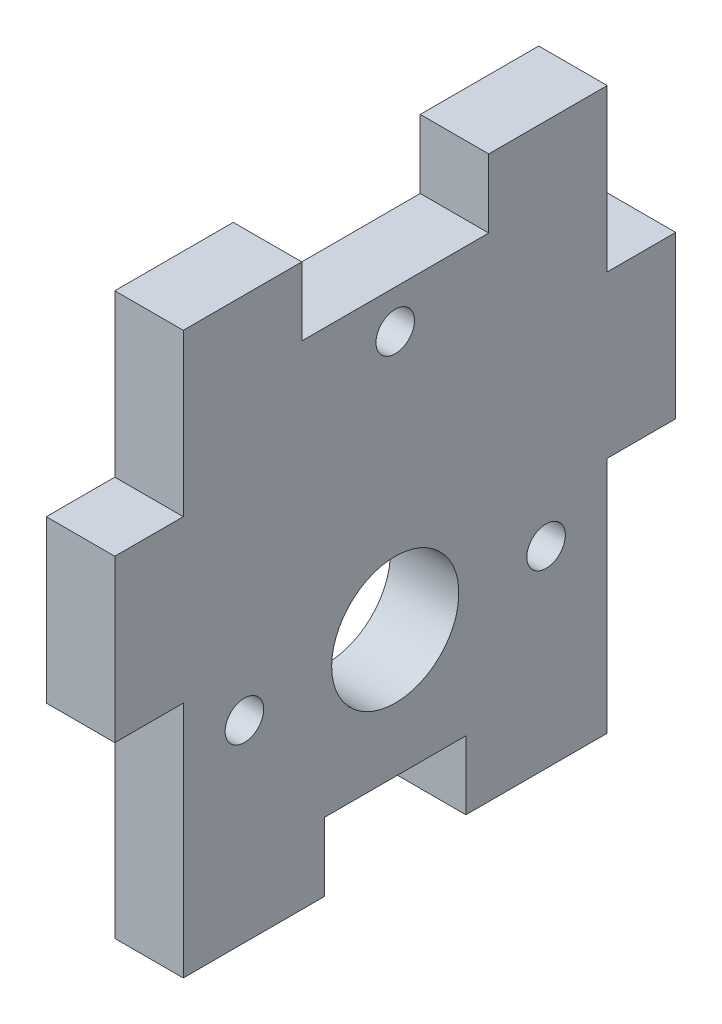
SolidWorks part; units mm, degrees
ref_plane "Front Plane" through (0, 0, 0) normal (0, 0, 1) x (1, 0, 0)
ref_plane "Top Plane" through (0, 0, 0) normal (0, 1, 0) x (1, 0, 0)
ref_plane "Right Plane" through (0, 0, 0) normal (1, 0, 0) x (0, 0, -1)
sketch "Sketch2" plane through (0, 0, 0) normal (1, 0, 0) x (0, 0, -1)
  line L1 (-16.51, -16.51) -> (16.51, -16.51)
  line L2 (-16.51, -16.51) -> (-16.51, 16.51)
  line L3 (-16.51, 16.51) -> (16.51, 16.51)
  line L4 (16.51, -16.51) -> (16.51, 16.51)
  line L5 (-16.51, -16.51) -> (16.51, 16.51) construction
  line L6 (-16.51, 16.51) -> (16.51, -16.51) construction
  point P0 (0, 0)
  dimension "D1" = 33.02
  dimension "D2" = 33.02
extrude "Boss-Extrude2" add sketch "Sketch2" along normal blind 5.334
sketch "Sketch3" plane through (5.334, 0, 0) normal (1, 0, 0) x (0, 0, -1)
  line L2 (-16.51, -16.51) -> (-16.51, -21.844)
  line L3 (-16.51, -21.844) -> (16.51, -21.844)
  line L4 (16.51, -16.51) -> (16.51, -21.844)
  line L5 (-16.51, -16.51) -> (-21.844, -16.51)
  line L7 (-16.51, 21.844) -> (-21.844, 21.844)
  line L8 (-21.844, -16.51) -> (-21.844, 21.844)
  line L10 (-16.51, 16.51) -> (-16.51, 21.844)
  line L11 (-16.51, 21.844) -> (16.51, 21.844)
  line L12 (16.51, 16.51) -> (16.51, 21.844)
  line L13 (16.51, 21.844) -> (21.844, 21.844)
  line L15 (16.51, -16.51) -> (21.844, -16.51)
  line L16 (21.844, 21.844) -> (21.844, -16.51)
extrude "Boss-Extrude6" add sketch "Sketch3" against normal through all contours L10 L7 L8 L5 M3 | L12 L11 L10 M2 | L16 L13 L12 L15 M1 | L4 L2 L3 M4
sketch "Sketch6" plane through (5.334, 0, 0) normal (1, 0, 0) x (0, 0, -1)
  line L0 (-16.51, -21.844) -> (16.51, -21.844) construction
  line L1 (-5.5033, -21.844) -> (5.5033, -21.844)
  line L2 (-5.5033, -21.844) -> (-5.5033, -16.51)
  line L3 (-5.5033, -16.51) -> (5.5033, -16.51)
  line L4 (5.5033, -21.844) -> (5.5033, -16.51)
  line L5 (-5.5033, -16.51) -> (-16.51, -16.51) construction
  line L6 (5.5033, -16.51) -> (16.51, -16.51) construction
extrude "Cut-Extrude2" cut sketch "Sketch6" against normal through all
other "Cavity2"
other "motorMountTop<2>@Platform1"
other "motorMountSide<1>@Platform2"
other "motorMountSide<2>@Platform2"
sketch "Sketch7" plane through (0, 0, 0) normal (-1, 0, 0) x (0, 0, 1)
  circle A0 centre (0, 13.51) radius 1.5 construction
  circle A1 centre (11.75, -6.8416) radius 1.5 construction
  circle A2 centre (0, -6.604) radius 4.953 construction
  circle A3 centre (-11.75, -6.8416) radius 1.5 construction
  circle A4 centre (0, 13.51) radius 1.5
  circle A5 centre (11.75, -6.8416) radius 1.5
  circle A6 centre (0, -6.604) radius 4.953
  circle A7 centre (-11.75, -6.8416) radius 1.5
extrude "Cut-Extrude3" cut sketch "Sketch7" against normal through all
equation "\"MDF\"=0.21"
equation "\"D1@Boss-Extrude2\"=\"MDF\""
